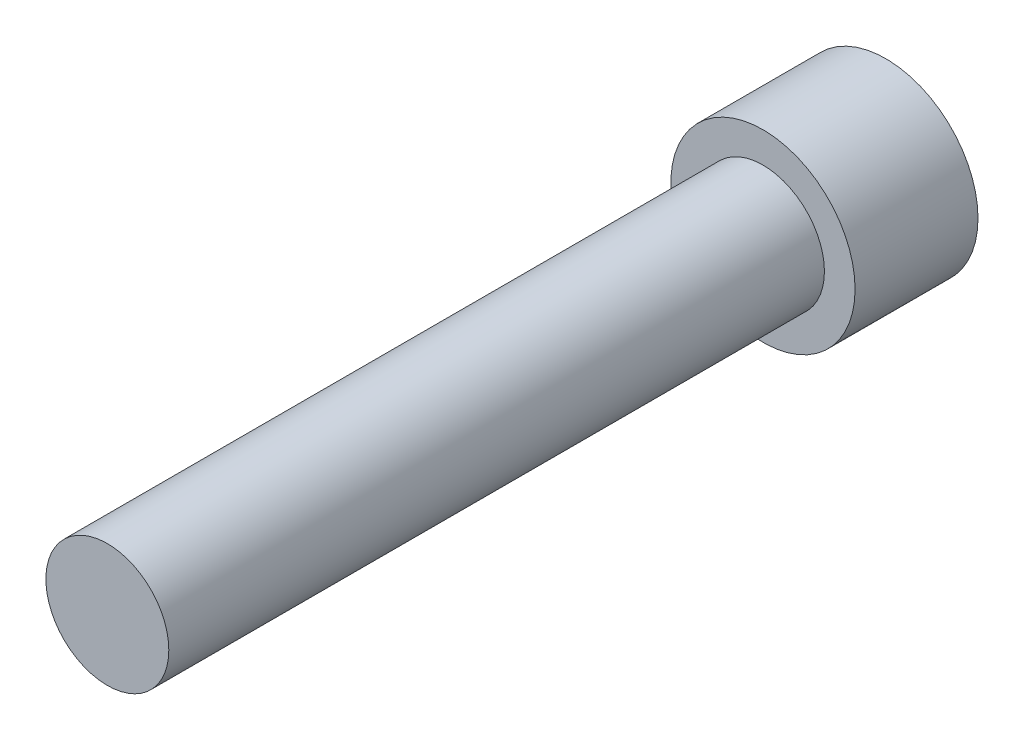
SolidWorks part; units mm, degrees
ref_plane "Front Plane" through (0, 0, 0) normal (0, 0, 1) x (1, 0, 0)
ref_plane "Top Plane" through (0, 0, 0) normal (0, 1, 0) x (1, 0, 0)
ref_plane "Right Plane" through (0, 0, 0) normal (1, 0, 0) x (0, 0, -1)
sketch "Sketch6" plane through (0, 0, 0) normal (1, 0, 0) x (0, 0, -1)
  line L0 (-50.8, 0) -> (22.525, 0) construction
  line L1 (7.8511, 0) -> (-7.8511, 0) construction
  line L2 (-50.8, 0) -> (-50.8, -4.7625)
  line L3 (-50.8, -4.7625) -> (0, -4.7625)
  line L4 (0, 7.8511) -> (0, -7.8511) construction
  line L5 (0, -4.7625) -> (0, -7.1374)
  line L6 (0, -7.1374) -> (9.525, -7.1374)
  line L7 (9.525, -7.1374) -> (9.525, 0)
  line L8 (9.525, 0) -> (-50.8, 0)
  dimension "L" = 50.8
  dimension "H" = 9.525
  dimension "A" = 14.2748
  dimension "D" = 9.525
revolve "Revolve1" add sketch "Sketch6" angle 360 about L0
sketch "Sketch7" plane through (0, 0, -9.525) normal (0, 0, -1) x (-1, 0, 0)
  line L2 (-3.9624, 2.2877) -> (-3.9624, -2.2877)
  line L4 (-3.9624, -2.2877) -> (0, -4.5754)
  line L5 (0, -4.5754) -> (3.9624, -2.2877)
  line L6 (3.9624, -2.2877) -> (3.9624, 2.2877)
  line L7 (3.9624, 2.2877) -> (0, 4.5754)
  line L8 (0, 4.5754) -> (-3.9624, 2.2877)
  circle A0 centre (0, 0) radius 3.9624 construction
  dimension "J" = 7.9248
extrude "HEX" cut sketch "Sketch7" against normal blind 5.842
